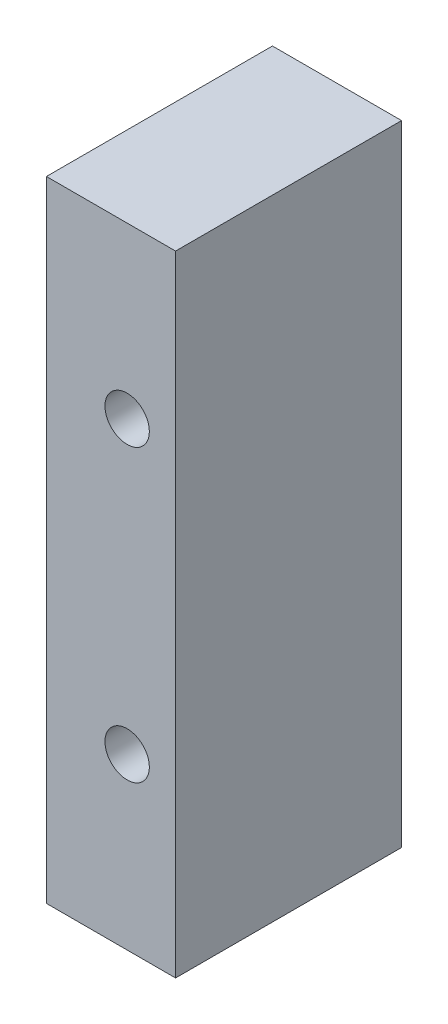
SolidWorks part; units mm, degrees
ref_plane "Face" through (0, 0, 0) normal (0, 0, 1) x (1, 0, 0)
ref_plane "Dessus" through (0, 0, 0) normal (0, 1, 0) x (1, 0, 0)
ref_plane "Droite" through (0, 0, 0) normal (1, 0, 0) x (0, 0, -1)
sketch "Esquisse1" plane through (0, 0, 0) normal (0, 0, 1) x (1, 0, 0)
  line L0 (-14.7461, 0) -> (31.0444, 0) construction
  line L1 (-8, 39) -> (8, 39)
  line L2 (-8, 39) -> (-8, -39)
  line L3 (-8, -39) -> (8, -39)
  line L4 (8, 39) -> (8, -39)
  line L5 (0, 24.2535) -> (0, -23.4774) construction
  dimension "D1" = 78
  dimension "D2" = 16
extrude "Extrusion1" add sketch "Esquisse1" along normal blind 28
sketch "Esquisse2" plane through (0, 0, 28) normal (0, 0, 1) x (1, 0, 0)
  line L0 (-5.9194, 0) -> (11.683, 0) construction
  line L1 (0, 8.3339) -> (0, -6.4646) construction
  line L2 (-8, 39) -> (-8, -39) construction
  circle A0 centre (2, 18) radius 2.75
  circle A1 centre (2, -18) radius 2.75
  dimension "D1" = 5.5
  dimension "D2" = 10
  dimension "D3" = 36
extrude "Enlèv. mat.-Extru.1" cut sketch "Esquisse2" against normal through all
